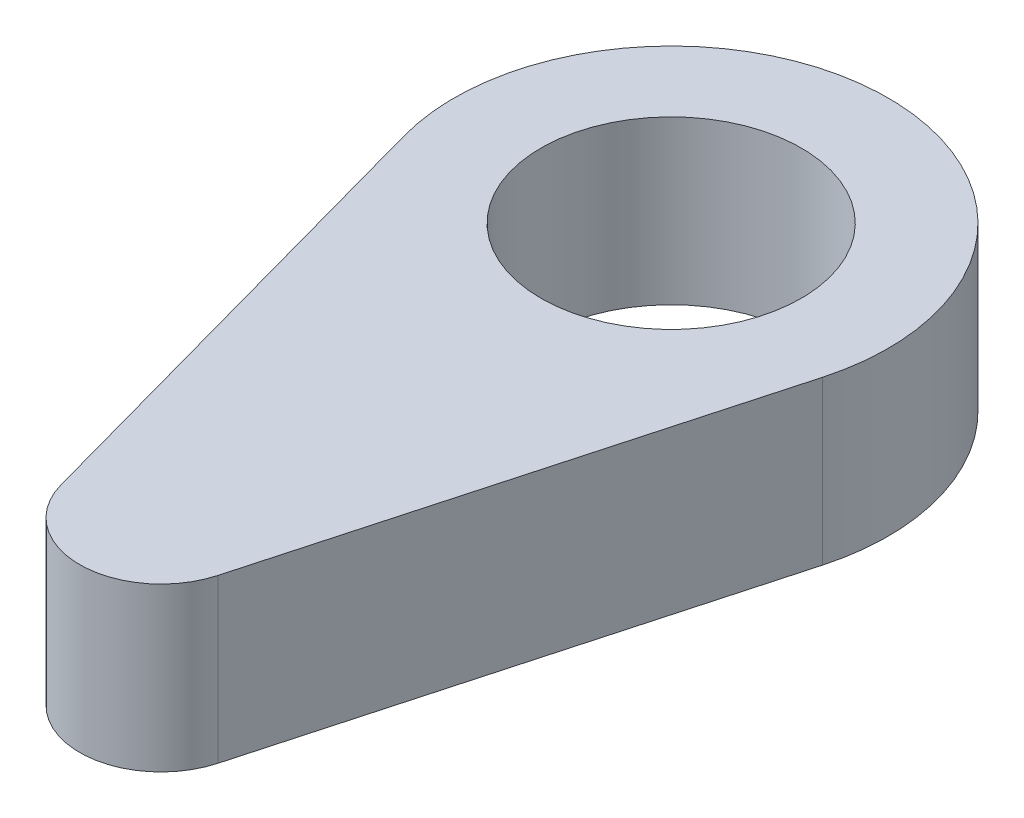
SolidWorks part; units mm, degrees
ref_plane "Front Plane" through (0, 0, 0) normal (0, 0, 1) x (1, 0, 0)
ref_plane "Top Plane" through (0, 0, 0) normal (0, 1, 0) x (1, 0, 0)
ref_plane "Right Plane" through (0, 0, 0) normal (1, 0, 0) x (0, 0, -1)
sketch "Sketch1" plane through (0, 0, 0) normal (0, 1, 0) x (1, 0, 0)
  line L0 (0, 0) -> (0, -9.404) construction
  line L1 (-3.8561, -1.0634) -> (-1.446, -9.8028)
  line L2 (3.8561, -1.0634) -> (1.446, -9.8028)
  line L3 (0, -9.404) -> (0, -10.904) construction
  circle A0 centre (0, 0) radius 2.4003
  arc A1 (3.8561, -1.0634) -> (-3.8561, -1.0634) centre (0, 0) ccw
  arc A2 (-1.446, -9.8028) -> (1.446, -9.8028) centre (0, -9.404) ccw
  point P3 (0, 0)
  point P9 (0, 0)
  dimension "D1" = 4.8006
  dimension "D2" = 3
  dimension "D3" = 8
  dimension "D4" = 10.904
extrude "Boss-Extrude1" add sketch "Sketch1" along normal blind 3
